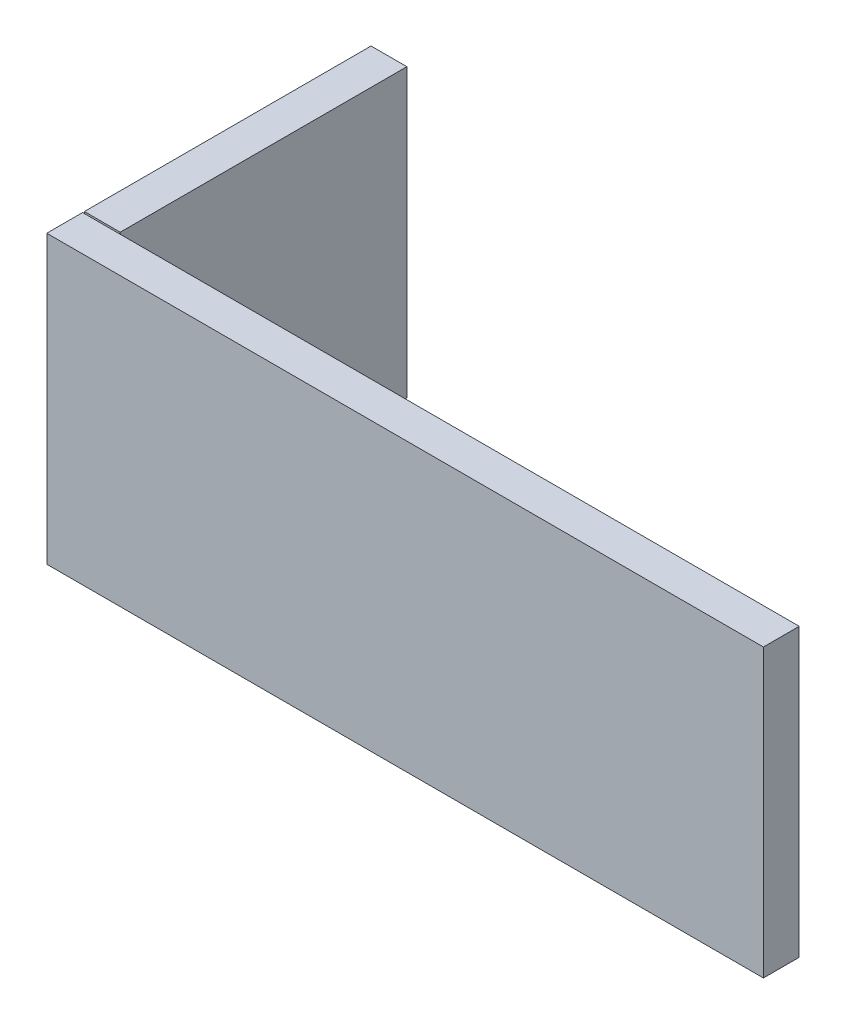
SolidWorks part; units mm, degrees
ref_plane "Front Plane" through (0, 0, 0) normal (0, 0, 1) x (1, 0, 0)
ref_plane "Top Plane" through (0, 0, 0) normal (0, 1, 0) x (1, 0, 0)
ref_plane "Right Plane" through (0, 0, 0) normal (1, 0, 0) x (0, 0, -1)
sketch "Sketch1" plane through (0, 0, 0) normal (0, 1, 0) x (1, 0, 0)
  line L1 (0, 0) -> (254, 0)
  line L2 (0, 0) -> (0, 12.7)
  line L3 (0, 12.7) -> (254, 12.7) construction
  line L4 (254, 0) -> (254, 12.7)
  line L9 (0, 13.335) -> (12.7, 13.335)
  line L10 (0, 13.335) -> (0, 114.935)
  line L11 (0, 114.935) -> (12.7, 114.935)
  line L12 (12.7, 13.335) -> (12.7, 114.935)
  dimension "D1" = 254
  dimension "D2" = 0.635
  dimension "D3" = 12.7
  dimension "D4" = 101.6
  dimension "D5" = 12.7
extrude "Boss-Extrude1" add sketch "Sketch1" along normal blind 101.6
